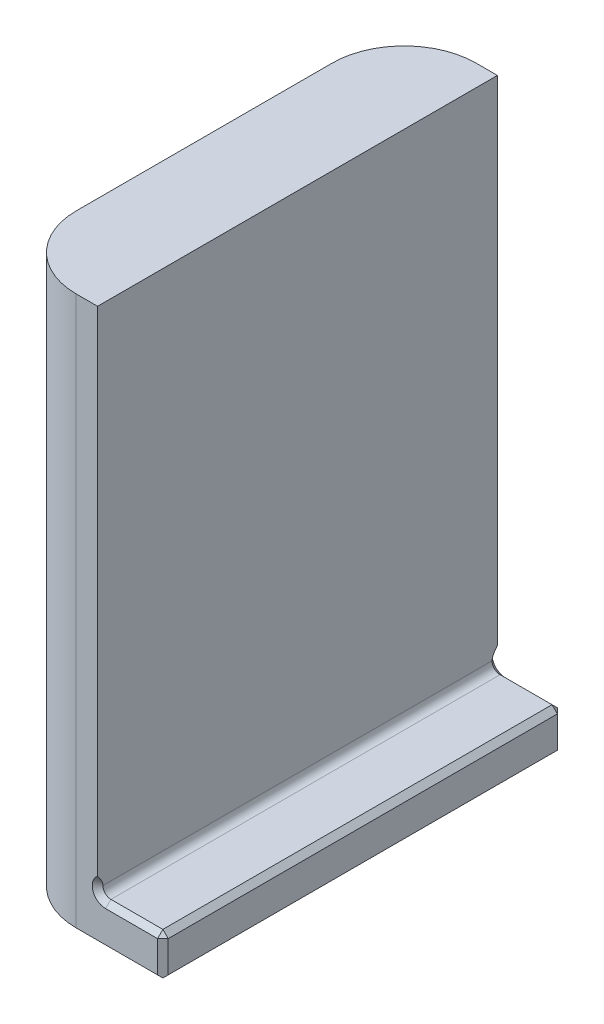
SolidWorks part; units mm, degrees
ref_plane "Front Plane" through (0, 0, 0) normal (0, 0, 1) x (1, 0, 0)
ref_plane "Top Plane" through (0, 0, 0) normal (0, 1, 0) x (1, 0, 0)
ref_plane "Right Plane" through (0, 0, 0) normal (1, 0, 0) x (0, 0, -1)
sketch "Sketch1" plane through (0, 0, 0) normal (0, 0, 1) x (1, 0, 0)
  line L0 (0, 0) -> (0, -26.924)
  line L1 (0, -26.924) -> (7.5565, -26.924)
  line L2 (7.5565, -26.924) -> (7.5565, -24.4094)
  line L3 (7.5565, -24.4094) -> (4.826, -24.4094)
  line L4 (4.445, -24.0284) -> (4.445, 0)
  line L5 (4.445, 0) -> (0, 0)
  arc A0 (4.826, -24.4094) -> (4.445, -24.0284) centre (4.826, -24.0284) cw
  dimension "D5" = 0.381
  dimension "D1" = 4.445
  dimension "D2" = 26.924
  dimension "D3" = 7.5565
  dimension "D4" = 2.5146
extrude "Boss-Extrude1" add sketch "Sketch1" along normal mid plane 19.05
fillet "Fillet1" radius 3.429 2 edges at (0, -13.462, -9.525) (0, -13.462, 9.525)
chamfer "Chamfer1" distance 0.762 angle 45 6 edges at (5.4928, -26.924, -9.525) (1.0043, -26.924, -8.5207) (0, -26.924, 0) (1.0043, -26.924, 8.5207) (7.5565, -26.924, 0) (5.4928, -26.924, 9.525)
chamfer "Chamfer2" distance 0.254 angle 45 5 edges at (7.5565, -25.2857, -9.525) (6.1913, -24.4094, -9.525) (7.5565, -25.2857, 9.525) (6.1913, -24.4094, 9.525) (7.5565, -24.4094, 0)
